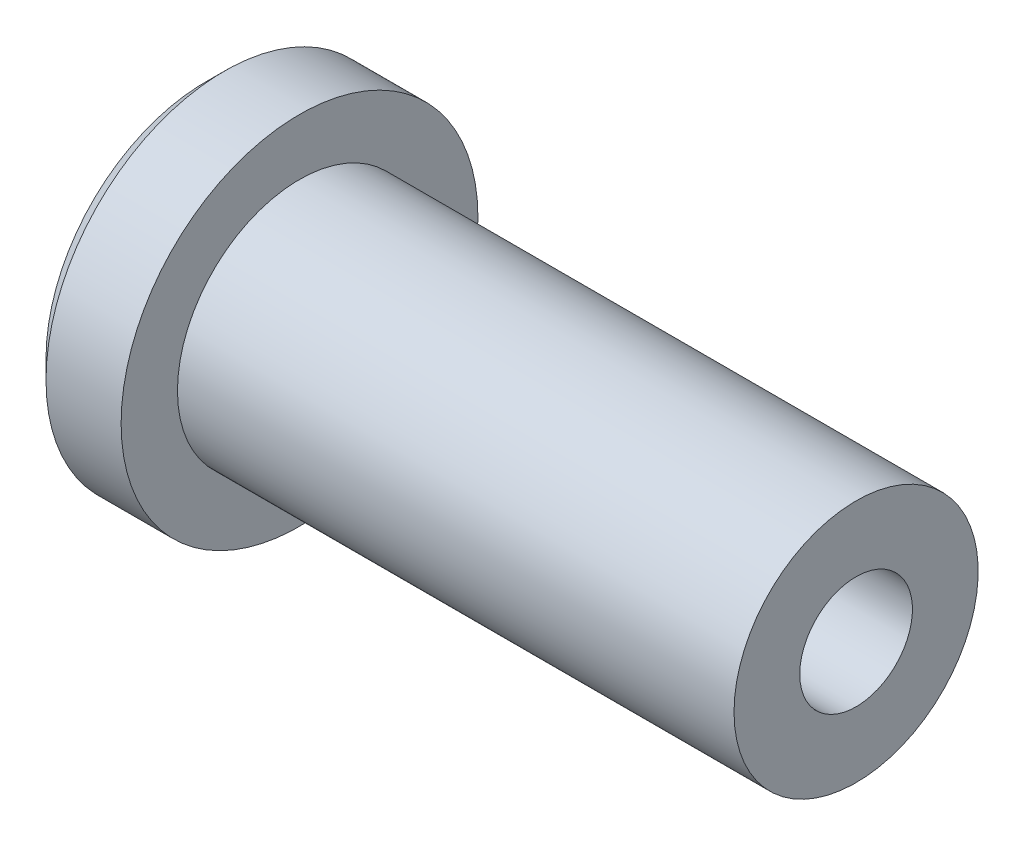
SolidWorks part; units mm, degrees
ref_plane "Plan1" through (0, 0, 0) normal (0, 0, 1) x (1, 0, 0)
ref_plane "Plan2" through (0, 0, 0) normal (0, 1, 0) x (1, 0, 0)
ref_plane "Plan3" through (0, 0, 0) normal (1, 0, 0) x (0, 0, -1)
sketch "Esquisse1" plane through (0, 0, 0) normal (0, 0, 1) x (1, 0, 0)
  line L0 (-10, 0) -> (120, 0) construction
  line L1 (0, 0) -> (0, 17)
  line L2 (2, 19) -> (10, 19)
  line L3 (10, 19) -> (10, 13)
  line L4 (10, 13) -> (69.272, 13)
  line L5 (69.272, 13) -> (69.272, 0)
  line L6 (0, 17) -> (2, 19)
  line L7 (0, 0) -> (69.272, 0)
  point P4 (0, 19)
  dimension "D1" = 2
  dimension "D2" = 45
  dimension "D3" = 10
  dimension "D4" = 13
  dimension "D5" = 19
  dimension "D6" = 69.272
revolve "Base-Révolution" add sketch "Esquisse1" angle 360 about L0
sketch "Esquisse2" plane through (0, 0, 0) normal (-1, 0, 0) x (0, 0, 1)
  circle A0 centre (0, 0) radius 9
  dimension "D1" = 18
extrude "Enlèv. mat.-Extru.1" cut sketch "Esquisse2" against normal blind 14
sketch "Esquisse3" plane through (14, 0, 0) normal (-1, 0, 0) x (0, 0, 1)
  circle A0 centre (0, 0) radius 6
  dimension "D1" = 12
extrude "Enlèv. mat.-Extru.2" cut sketch "Esquisse3" against normal through all
